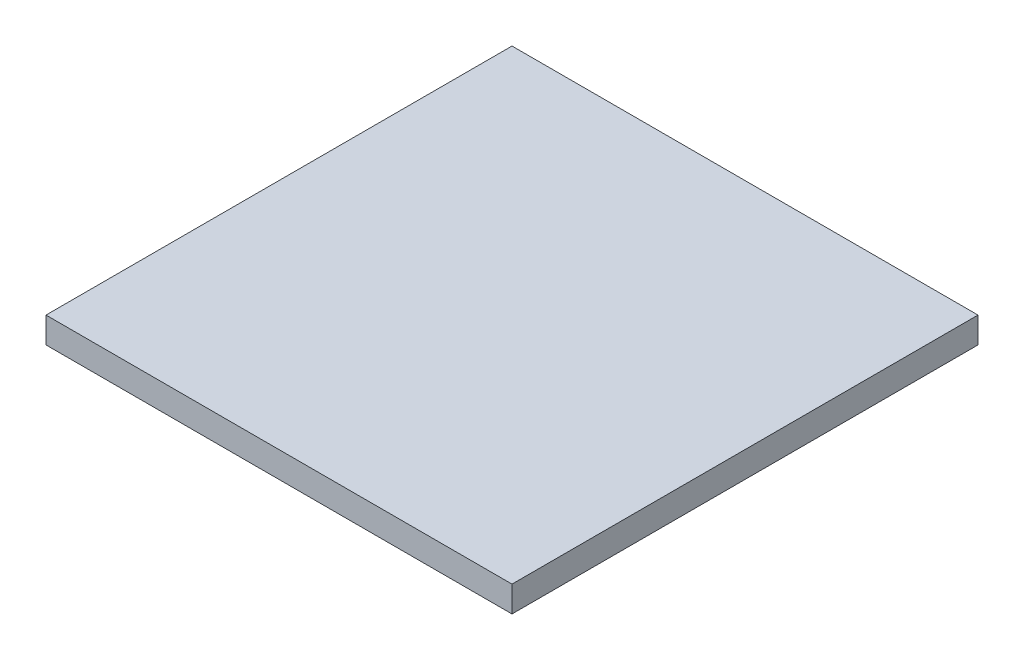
SolidWorks part; units mm, degrees
ref_plane "Front" through (0, 0, 0) normal (0, 0, 1) x (1, 0, 0)
ref_plane "Top" through (0, 0, 0) normal (0, 1, 0) x (1, 0, 0)
ref_plane "Right" through (0, 0, 0) normal (1, 0, 0) x (0, 0, -1)
sketch "Sketch1" plane through (0, 0, 0) normal (0, 1, 0) x (1, 0, 0)
  line L0 (-228.6, -228.6) -> (228.6, 228.6) construction
  line L1 (-228.6, -228.6) -> (228.6, -228.6)
  line L2 (-228.6, -228.6) -> (-228.6, 228.6)
  line L3 (-228.6, 228.6) -> (228.6, 228.6)
  line L4 (228.6, -228.6) -> (228.6, 228.6)
  dimension "D1" = 457.2
extrude "Extrude1" add sketch "Sketch1" against normal blind 25.4
